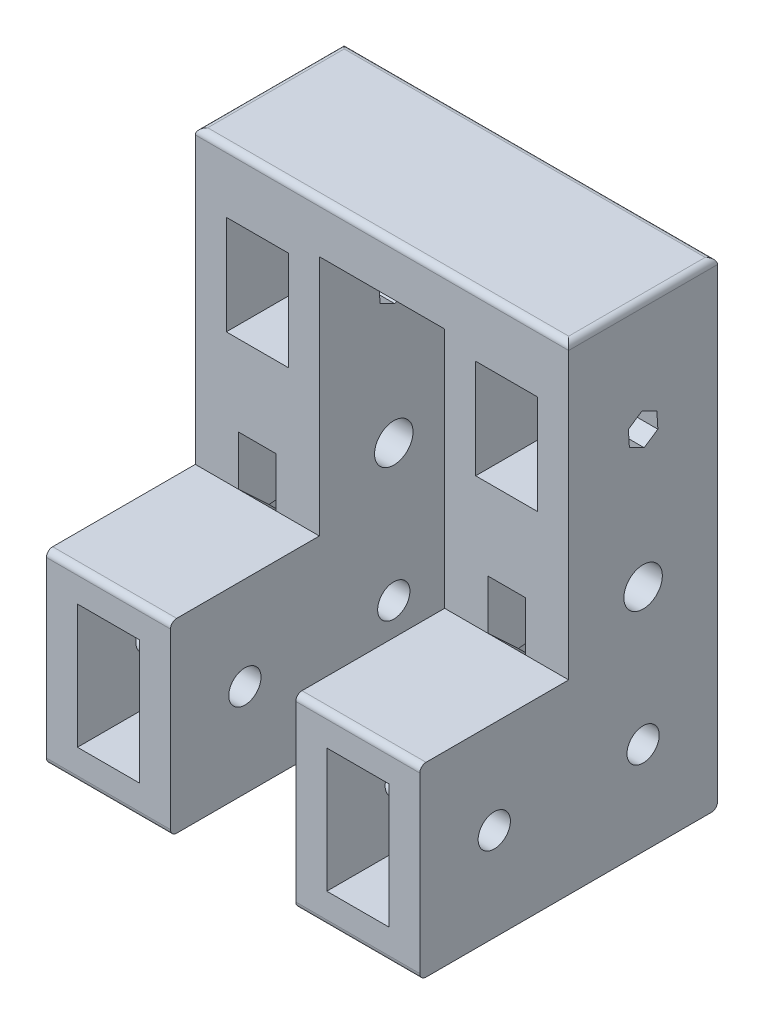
SolidWorks part; units mm, degrees
ref_plane "正面" through (0, 0, 0) normal (1, 0, 0) x (0, 1, 0)
ref_plane "平面" through (0, 0, 0) normal (0, 0, 1) x (0, 1, 0)
ref_plane "右側面" through (0, 0, 0) normal (0, 1, 0) x (-1, 0, 0)
sketch "ｽｹｯﾁ1" plane through (0, 0, 0) normal (1, 0, 0) x (0, 1, 0)
  line L0 (-31.7958, 21.3486) -> (-31.7958, -26.6514)
  line L1 (-31.7958, -26.6514) -> (45.2042, -26.6514)
  line L2 (45.2042, -26.6514) -> (45.2042, -2.6514)
  line L3 (45.2042, -2.6514) -> (-1.7958, -2.6514)
  line L4 (-1.7958, -2.6514) -> (-1.7958, 21.3486)
  line L5 (-1.7958, 21.3486) -> (-31.7958, 21.3486)
  dimension "D1" = 77
  dimension "D2" = 30
  dimension "D3" = 48
  dimension "D4" = 24
extrude "ﾎﾞｽ - 押し出し1" add sketch "ｽｹｯﾁ1" along normal mid plane 60.2
sketch "ｽｹｯﾁ2" plane through (30.1, 0, 0) normal (1, 0, 0) x (0, 1, 0)
  line L0 (-1.7958, 21.3486) -> (-31.7958, 21.3486) construction
  line L1 (45.2042, -2.6514) -> (-1.7958, -2.6514) construction
  line L2 (-31.7958, 21.3486) -> (-31.7958, -26.6514) construction
  line L3 (45.2042, -2.6514) -> (-1.7958, -2.6514) construction
  line L4 (28.6725, -16.8645) -> (29.8549, -14.4864)
  line L5 (29.8549, -14.4864) -> (28.3867, -12.2734)
  line L6 (28.3867, -12.2734) -> (25.736, -12.4383)
  line L7 (25.736, -12.4383) -> (24.5535, -14.8164)
  line L8 (24.5535, -14.8164) -> (26.0218, -17.0295)
  line L9 (26.0218, -17.0295) -> (28.6725, -16.8645)
  line L10 (-31.7958, 21.3486) -> (-31.7958, -26.6514) construction
  circle A0 centre (-16.7958, 9.3486) radius 2.6
  circle A1 centre (-16.7958, -14.6514) radius 2.6
  circle A2 centre (5.2042, -14.6514) radius 3.1
  circle A4 centre (27.2042, -14.6514) radius 2.3 construction
  point P7 (25.1448, -13.6274)
  dimension "D9" = 5.2
  dimension "D10" = 5.2
  dimension "D11" = 6.2
  dimension "D12" = 59
  dimension "D1" = 12
  dimension "D2" = 36
  dimension "D3" = 12
  dimension "D4" = 4.6
  dimension "D5" = 15
  dimension "D6" = 15
  dimension "D7" = 37
  dimension "D8" = 12
extrude "ｶｯﾄ - 押し出し1" cut sketch "ｽｹｯﾁ2" against normal through all
sketch "ｽｹｯﾁ3" plane through (0, -31.7958, 0) normal (0, -1, 0) x (1, 0, 0)
  line L0 (30.1, 21.3486) -> (-30.1, 21.3486) construction
  line L1 (-10.1, 21.3486) -> (10.1, 21.3486)
  line L2 (-10.1, 21.3486) -> (-10.1, -26.6514)
  line L3 (-10.1, -26.6514) -> (10.1, -26.6514)
  line L4 (10.1, 21.3486) -> (10.1, -26.6514)
  line L5 (30.1, -26.6514) -> (-30.1, -26.6514) construction
  dimension "D1" = 20.2
  dimension "D2" = 10.1
extrude "ｶｯﾄ - 押し出し2" cut sketch "ｽｹｯﾁ3" against normal blind 69
sketch "ｽｹｯﾁ4" plane through (0, 0, -2.6514) normal (0, 0, 1) x (1, 0, 0)
  line L0 (-10.1, -1.7958) -> (-30.1, -1.7958) construction
  line L1 (-25.1, 35.2042) -> (-15.1, 35.2042)
  line L2 (-25.1, 35.2042) -> (-25.1, 19.2042)
  line L3 (-25.1, 19.2042) -> (-15.1, 19.2042)
  line L4 (-15.1, 35.2042) -> (-15.1, 19.2042)
  line L5 (-25.1, 35.2042) -> (-15.1, 19.2042) construction
  line L6 (-25.1, 19.2042) -> (-15.1, 35.2042) construction
  line L7 (15.1, 35.2042) -> (25.1, 35.2042)
  line L8 (15.1, 35.2042) -> (15.1, 19.2042)
  line L9 (15.1, 19.2042) -> (25.1, 19.2042)
  line L10 (25.1, 35.2042) -> (25.1, 19.2042)
  line L11 (15.1, 35.2042) -> (25.1, 19.2042) construction
  line L12 (15.1, 19.2042) -> (25.1, 35.2042) construction
  line L13 (-25.1, -1.7958) -> (-20.1, -1.7958)
  line L22 (30.1, 45.2042) -> (30.1, -1.7958) construction
  line L23 (-30.1, 45.2042) -> (-30.1, -1.7958) construction
  line L25 (30.1, 45.2042) -> (-30.1, 45.2042) construction
  point P0 (-20.1, 27.2042)
  point P5 (20.1, 27.2042)
  dimension "D1" = 10
  dimension "D2" = 16
  dimension "D3" = 10
  dimension "D4" = 16
  dimension "D5" = 18
  dimension "D6" = 18
  dimension "D9" = 5
  dimension "D12" = 5
extrude "ｶｯﾄ - 押し出し3" cut sketch "ｽｹｯﾁ4" against normal through all contours L2 L1 L4 L3 | L8 L7 L10 L9
sketch "ｽｹｯﾁ8" plane through (0, 0, -26.6514) normal (0, 0, -1) x (1, 0, 0)
  line L0 (-10.1, 31.7958) -> (-30.1, 31.7958) construction
  line L1 (-25.1, 24.2958) -> (-15.1, 24.2958)
  line L2 (-25.1, 24.2958) -> (-25.1, 9.2958)
  line L3 (-25.1, 9.2958) -> (-15.1, 9.2958)
  line L4 (-15.1, 24.2958) -> (-15.1, 9.2958)
  line L5 (-25.1, 24.2958) -> (-15.1, 9.2958) construction
  line L6 (-25.1, 9.2958) -> (-15.1, 24.2958) construction
  line L7 (-30.1, 31.7958) -> (-30.1, -45.2042) construction
  point P0 (-20.1, 16.7958)
  dimension "D1" = 15
  dimension "D2" = 10
  dimension "D3" = 15
  dimension "D4" = 5
sketch "ｽｹｯﾁ9" plane through (0, 0, -2.6514) normal (0, 0, 1) x (1, 0, 0)
  line L0 (-10.1, -1.7958) -> (-30.1, -1.7958) construction
  line L1 (-23.1, -1.7958) -> (-17.1, -1.7958)
  line L2 (-23.1, -1.7958) -> (-23.1, 6.2042)
  line L3 (-23.1, 6.2042) -> (-17.1, 6.2042)
  line L4 (-17.1, -1.7958) -> (-17.1, 6.2042)
  line L5 (-30.1, 45.2042) -> (-30.1, -1.7958) construction
  dimension "D1" = 6
  dimension "D2" = 7
  dimension "D3" = 8
loft "ｶｯﾄ - ﾛﾌﾄ1" cut profiles "ｽｹｯﾁ9", "ｽｹｯﾁ8"
sketch "ｽｹｯﾁ10" plane through (0, 0, -2.6514) normal (0, 0, 1) x (1, 0, 0)
  line L0 (30.1, -1.7958) -> (10.1, -1.7958) construction
  line L1 (17.1, -1.7958) -> (23.1, -1.7958)
  line L2 (17.1, -1.7958) -> (17.1, 6.2042)
  line L3 (17.1, 6.2042) -> (23.1, 6.2042)
  line L4 (23.1, -1.7958) -> (23.1, 6.2042)
  line L5 (10.1, 37.2042) -> (10.1, -1.7958) construction
  dimension "D1" = 6
  dimension "D2" = 8
  dimension "D3" = 7
sketch "ｽｹｯﾁ11" plane through (0, 0, -26.6514) normal (0, 0, -1) x (1, 0, 0)
  line L0 (30.1, 31.7958) -> (10.1, 31.7958) construction
  line L1 (15.1, 24.2958) -> (25.1, 24.2958)
  line L2 (15.1, 24.2958) -> (15.1, 9.2958)
  line L3 (15.1, 9.2958) -> (25.1, 9.2958)
  line L4 (25.1, 24.2958) -> (25.1, 9.2958)
  line L5 (15.1, 24.2958) -> (25.1, 9.2958) construction
  line L6 (15.1, 9.2958) -> (25.1, 24.2958) construction
  line L7 (10.1, -37.2042) -> (10.1, 31.7958) construction
  point P0 (20.1, 16.7958)
  dimension "D1" = 15
  dimension "D2" = 10
  dimension "D3" = 5
  dimension "D4" = 15
loft "ｶｯﾄ - ﾛﾌﾄ2" cut profiles "ｽｹｯﾁ11", "ｽｹｯﾁ10"
sketch "ｽｹｯﾁ12" plane through (0, 0, -26.6514) normal (0, 0, -1) x (1, 0, 0)
  line L0 (-15.1, 9.2958) -> (-15.1, 24.2958) construction
  line L1 (-25.1, 26.7958) -> (-15.1, 26.7958)
  line L2 (-25.1, 26.7958) -> (-25.1, 6.7958)
  line L3 (-25.1, 6.7958) -> (-15.1, 6.7958)
  line L4 (-15.1, 26.7958) -> (-15.1, 6.7958)
  line L5 (-25.1, 26.7958) -> (-15.1, 6.7958) construction
  line L6 (-25.1, 6.7958) -> (-15.1, 26.7958) construction
  line L7 (25.1, 9.2958) -> (25.1, 24.2958) construction
  line L8 (15.1, 26.7958) -> (25.1, 26.7958)
  line L9 (15.1, 26.7958) -> (15.1, 6.7958)
  line L10 (15.1, 6.7958) -> (25.1, 6.7958)
  line L11 (25.1, 26.7958) -> (25.1, 6.7958)
  line L12 (15.1, 26.7958) -> (25.1, 6.7958) construction
  line L13 (15.1, 6.7958) -> (25.1, 26.7958) construction
  line L14 (30.1, 31.7958) -> (10.1, 31.7958) construction
  line L16 (-10.1, 31.7958) -> (-30.1, 31.7958) construction
  point P0 (-20.1, 16.7958)
  point P7 (20.1, 16.7958)
  dimension "D1" = 10
  dimension "D2" = 20
  dimension "D3" = 20
  dimension "D4" = 10
  dimension "D5" = 15
  dimension "D6" = 15
extrude "ｶｯﾄ - 押し出し4" cut sketch "ｽｹｯﾁ12" against normal through all
fillet "ﾌｨﾚｯﾄ1" radius 1 10 edges at (0, 45.2042, -26.6514) (30.1, 45.2042, -14.6514) (0, 45.2042, -2.6514) (-30.1, 45.2042, -14.6514) (-20.1, -31.7958, -26.6514) (-20.1, -31.7958, 21.3486) (-20.1, -1.7958, 21.3486) (20.1, -1.7958, 21.3486) (20.1, -31.7958, 21.3486) (20.1, -31.7958, -26.6514)
